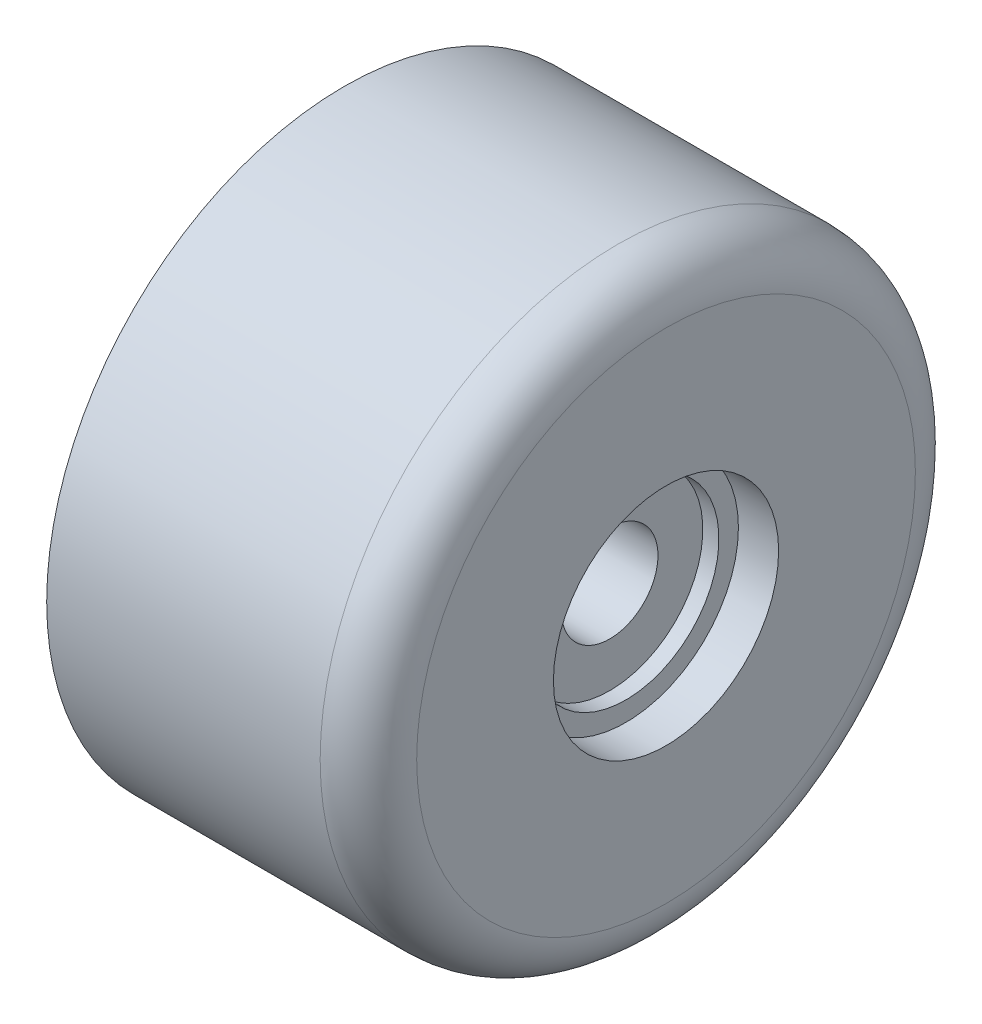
SolidWorks part; units mm, degrees
ref_plane "Ön Düzlem" through (0, 0, 0) normal (0, 0, 1) x (1, 0, 0)
ref_plane "Üst Düzlem" through (0, 0, 0) normal (0, 1, 0) x (1, 0, 0)
ref_plane "Sağ Düzlem" through (0, 0, 0) normal (1, 0, 0) x (0, 0, -1)
sketch "Çizim1" plane through (0, 0, 0) normal (0, 0, 1) x (1, 0, 0)
  line L0 (0, 0) -> (40.9097, 0) construction
  line L1 (0, 18.5) -> (0, 17.1133)
  line L2 (0, 18.5) -> (17, 18.5)
  line L3 (20, 15.5) -> (20, 7)
  line L4 (20, 7) -> (17.5, 7)
  line L5 (17.5, 7) -> (17.5, 5.7878)
  line L6 (17.5, 5.7878) -> (16.5, 5.7878)
  line L7 (16.5, 5.7878) -> (16.5, 3)
  line L8 (0, 17.1133) -> (17.5, 17.1133)
  line L9 (16.5, 3) -> (0, 3)
  line L10 (17.5, 17.1133) -> (18.3592, 15.5)
  line L11 (18.3592, 15.5) -> (18.3592, 7.6157)
  line L12 (18.3592, 7.6157) -> (17, 7.6157)
  line L13 (17, 7.6157) -> (17, 6.414)
  line L14 (17, 6.414) -> (15.5681, 6.414)
  line L15 (15.5681, 6.414) -> (15.5681, 3.5453)
  line L16 (15.5681, 3.5453) -> (0, 3.5453)
  line L17 (0, 3.5453) -> (0, 3)
  arc A0 (17, 18.5) -> (20, 15.5) centre (17, 15.5) cw
  dimension "D1" = 3
revolve "Döndür1" add sketch "Çizim1" angle 360 about L0
